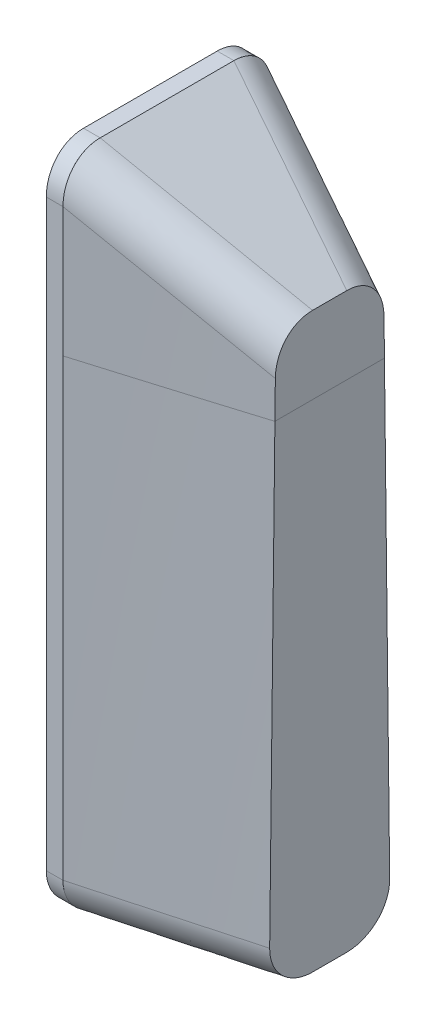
SolidWorks part; units mm, degrees
ref_plane "Alzado" through (0, 0, 0) normal (0, 0, 1) x (1, 0, 0)
ref_plane "Planta" through (0, 0, 0) normal (0, 1, 0) x (1, 0, 0)
ref_plane "Vista lateral" through (0, 0, 0) normal (1, 0, 0) x (0, 0, -1)
sketch "Croquis1" plane through (0, 0, 0) normal (0, 0, 1) x (1, 0, 0)
  line L0 (0, 0) -> (0, 160) construction
  line L1 (0, 160) -> (39.07, 137.672) construction
  line L2 (39.07, 137.672) -> (39.07, 0) construction
  line L3 (39.07, 0) -> (0, 0) construction
  dimension "D1" = 160
  dimension "D2" = 45
sketch "Croquis5" plane through (0, 0, 0) normal (0, 1, 0) x (1, 0, 0)
  line L0 (0, 0) -> (0, -25)
  line L1 (0, 0) -> (0, 25)
  line L2 (0, 25) -> (39.07, 14.5312)
  line L3 (39.07, 14.5312) -> (39.07, -14.5312)
  line L4 (39.07, -14.5312) -> (0, -25)
  dimension "D1" = 25
  dimension "D2" = 25
  dimension "D3" = 75
  dimension "D4" = 75
ref_plane "Plano2" through (68.9267, 120.6093, 0) normal (-0.4962, -0.8682, 0) x (0.8682, -0.4962, 0)
sketch "Croquis6" plane through (68.9267, 120.6093, 0) normal (-0.4962, -0.8682, 0) x (0.8682, -0.4962, 0)
  line L0 (-79.3884, 0) -> (-79.3884, 25)
  line L1 (-79.3884, 0) -> (-79.3884, -25)
  line L2 (-79.3884, 25) -> (-34.3884, 12.9423)
  line L3 (-34.3884, 12.9423) -> (-34.3884, -12.9423)
  line L4 (-34.3884, -12.9423) -> (-79.3884, -25)
  dimension "D1" = 25
  dimension "D2" = 25
  dimension "D3" = 75
  dimension "D4" = 75
loft "Recubrir1" add profiles "Croquis6", "Croquis5"
fillet "Redondeo1" radius 10 4 edges
sketch "Croquis7" plane through (0, 0, 0) normal (-1, 0, 0) x (0, 0, 1)
  line L6 (-25, 150.155) -> (-25, 10)
  line L7 (-14.6406, 0) -> (0, 0)
  line L8 (0, 0) -> (14.6406, 0)
  line L9 (25, 10) -> (25, 150.155)
  line L10 (16.0609, 160) -> (0, 160)
  line L11 (0, 160) -> (-16.0609, 160)
  line L12 (-25, 150.155) -> (-25, 10)
  line L13 (-14.6406, 0) -> (0, 0)
  line L14 (0, 0) -> (14.6406, 0)
  line L15 (25, 10) -> (25, 150.155)
  line L16 (16.0609, 160) -> (0, 160)
  line L17 (0, 160) -> (-16.0609, 160)
  spline S4 degree 3 poles (3880.9468, 860.7883) (494.7457, 218.8856) (-37.0995, 66.7661) (-24.7266, 7.6937) (-24.6419, 7.3721) (-24.4383, 6.7347) (-24.3193, 6.4195) (-23.9194, 5.5042) (-23.5939, 4.9266) (-23.0183, 4.1087) (-22.8106, 3.8429) (-22.3736, 3.3377) (-22.1439, 3.0974) (-21.4222, 2.4125) (-20.8967, 2.0026) (-19.7635, 1.2837) (-19.171, 0.984) (-18.2453, 0.6194) (-17.9305, 0.5122) (-17.2884, 0.3268) (-16.9607, 0.2487) (61.4859, -14.5892) (247.7847, 844.2737) (709.8719, 3930.3389) knots -11.189745 -11.189745 -11.189745 -11.189745 0.125 0.125 0.1875 0.1875 0.25 0.25 0.375 0.375 0.4375 0.4375 0.5 0.5 0.625 0.625 0.75 0.75 0.8125 0.8125 0.875 0.875 15.752784 15.752784 15.752784 15.752784 only from (-25, 10) to (-14.6406, 0)
  spline S5 degree 3 poles (-841.808, 3904.3773) (-209.1046, 555.1016) (-47.2488, -11.8517) (16.9511, 0.2466) (17.2742, 0.3232) (17.9152, 0.5072) (18.2346, 0.6155) (19.1676, 0.982) (19.7588, 1.2817) (20.5998, 1.8138) (20.8724, 2.005) (21.4017, 2.4163) (21.6566, 2.6353) (22.3809, 3.3217) (22.815, 3.8219) (23.3912, 4.6375) (23.5716, 4.922) (23.9009, 5.5051) (24.0496, 5.8028) (24.4486, 6.7141) (24.6525, 7.3456) (24.8605, 8.3304) (24.9128, 8.6628) (31.784, 74.3842) (-627.4827, 204.2432) (-3929.9593, 589.933) knots -12.133603 -12.133603 -12.133603 -12.133603 0.125 0.125 0.1875 0.1875 0.25 0.25 0.375 0.375 0.4375 0.4375 0.5 0.5 0.625 0.625 0.6875 0.6875 0.75 0.75 0.875 0.875 0.9375 0.9375 13.208978 13.208978 13.208978 13.208978 only from (14.6406, 0) to (25, 10)
  spline S6 degree 3 poles (3997.6896, 493.317) (-1133.0662, -227.6732) (39.7426, 56.8965) (24.763, 152.6108) (24.6194, 153.2112) (24.2217, 154.3946) (23.9737, 154.9591) (23.3765, 156.0301) (23.0274, 156.537) (22.2138, 157.4853) (21.7633, 157.9096) (21.028, 158.4658) (20.7726, 158.6381) (20.2405, 158.9556) (19.9619, 159.1015) (19.1127, 159.4874) (18.526, 159.6789) (17.6165, 159.8717) (17.307, 159.9202) (-55.8992, 167.4687) (-189.2733, -720.9033) (66.3339, 4152.8308) knots -19.421337 -19.421337 -19.421337 -19.421337 0.125 0.125 0.25 0.25 0.375 0.375 0.5 0.5 0.625 0.625 0.6875 0.6875 0.75 0.75 0.875 0.875 0.9375 0.9375 15.600185 15.600185 15.600185 15.600185 only from (25, 150.155) to (16.0609, 160)
  spline S7 degree 3 poles (-347.7414, 4128.1446) (499.0069, -1686.1904) (85.5813, 181.517) (-18.2038, 159.7479) (-18.5028, 159.6684) (-19.0953, 159.4755) (-19.3858, 159.3628) (-20.2292, 158.981) (-20.7588, 158.6674) (-21.5037, 158.1069) (-21.7431, 157.9052) (-22.194, 157.4817) (-22.4071, 157.2589) (-22.8096, 156.7919) (-22.9989, 156.5477) (-23.354, 156.0382) (-23.5197, 155.7727) (-23.9728, 154.9619) (-24.2205, 154.3969) (-24.5172, 153.5159) (-24.6038, 153.2155) (-24.7501, 152.6125) (-24.8102, 152.3092) (-38.2134, 66.7523) (906.2321, -148.3983) (-4005.453, 430.6693) knots -21.315227 -21.315227 -21.315227 -21.315227 0.125 0.125 0.1875 0.1875 0.25 0.25 0.375 0.375 0.4375 0.4375 0.5 0.5 0.5625 0.5625 0.625 0.625 0.75 0.75 0.8125 0.8125 0.875 0.875 18.347767 18.347767 18.347767 18.347767 only from (-16.0609, 160) to (-25, 150.155)
  spline S8 degree 3 poles (-25, 10) (-25, 9.3277) (-24.9305, 8.6672) (-24.7266, 7.6937) (-24.6419, 7.3721) (-24.4383, 6.7347) (-24.3193, 6.4195) (-23.9194, 5.5042) (-23.5939, 4.9266) (-23.0183, 4.1087) (-22.8106, 3.8429) (-22.3736, 3.3377) (-22.1439, 3.0974) (-21.4222, 2.4125) (-20.8967, 2.0026) (-19.7635, 1.2837) (-19.171, 0.984) (-18.2453, 0.6194) (-17.9305, 0.5122) (-17.2884, 0.3268) (-16.9607, 0.2487) (-15.9762, 0.0625) (-15.3123, 0) (-14.6406, 0) knots 0 0 0 0 0.125 0.125 0.1875 0.1875 0.25 0.25 0.375 0.375 0.4375 0.4375 0.5 0.5 0.625 0.625 0.75 0.75 0.8125 0.8125 0.875 0.875 1 1 1 1
  spline S9 degree 3 poles (14.6406, 0) (15.3127, 0) (15.9742, 0.0625) (16.9511, 0.2466) (17.2742, 0.3232) (17.9152, 0.5072) (18.2346, 0.6155) (19.1676, 0.982) (19.7588, 1.2817) (20.5998, 1.8138) (20.8724, 2.005) (21.4017, 2.4163) (21.6566, 2.6353) (22.3809, 3.3217) (22.815, 3.8219) (23.3912, 4.6375) (23.5716, 4.922) (23.9009, 5.5051) (24.0496, 5.8028) (24.4486, 6.7141) (24.6525, 7.3456) (24.8605, 8.3304) (24.9128, 8.6628) (24.9825, 9.3289) (25, 9.6636) (25, 10) knots 0 0 0 0 0.125 0.125 0.1875 0.1875 0.25 0.25 0.375 0.375 0.4375 0.4375 0.5 0.5 0.625 0.625 0.6875 0.6875 0.75 0.75 0.875 0.875 0.9375 0.9375 1 1 1 1
  spline S10 degree 3 poles (25, 150.155) (25, 150.7784) (24.9534, 151.3943) (24.763, 152.6108) (24.6194, 153.2112) (24.2217, 154.3946) (23.9737, 154.9591) (23.3765, 156.0301) (23.0274, 156.537) (22.2138, 157.4853) (21.7633, 157.9096) (21.028, 158.4658) (20.7726, 158.6381) (20.2405, 158.9556) (19.9619, 159.1015) (19.1127, 159.4874) (18.526, 159.6789) (17.6165, 159.8717) (17.307, 159.9202) (16.6856, 159.9842) (16.3738, 160) (16.0609, 160) knots 0 0 0 0 0.125 0.125 0.25 0.25 0.375 0.375 0.5 0.5 0.625 0.625 0.6875 0.6875 0.75 0.75 0.875 0.875 0.9375 0.9375 1 1 1 1
  spline S11 degree 3 poles (-16.0609, 160) (-16.685, 160) (-17.2988, 159.9377) (-18.2038, 159.7479) (-18.5028, 159.6684) (-19.0953, 159.4755) (-19.3858, 159.3628) (-20.2292, 158.981) (-20.7588, 158.6674) (-21.5037, 158.1069) (-21.7431, 157.9052) (-22.194, 157.4817) (-22.4071, 157.2589) (-22.8096, 156.7919) (-22.9989, 156.5477) (-23.354, 156.0382) (-23.5197, 155.7727) (-23.9728, 154.9619) (-24.2205, 154.3969) (-24.5172, 153.5159) (-24.6038, 153.2155) (-24.7501, 152.6125) (-24.8102, 152.3092) (-24.9535, 151.3944) (-25, 150.7778) (-25, 150.155) knots 0 0 0 0 0.125 0.125 0.1875 0.1875 0.25 0.25 0.375 0.375 0.4375 0.4375 0.5 0.5 0.5625 0.5625 0.625 0.625 0.75 0.75 0.8125 0.8125 0.875 0.875 1 1 1 1
  dimension "D1" = 0
extrude "Saliente-Extruir1" add sketch "Croquis7" along normal blind 4 separate body
sketch "Croquis8" plane through (-4, 0, 0) normal (-1, 0, 0) x (0, 0, 1)
  line L1 (0.4368, 130.8347) -> (-0.4368, 130.8347)
  line L2 (2.4368, 132.8347) -> (2.4368, 141.1512)
  line L3 (0.4368, 143.1512) -> (-0.4368, 143.1512)
  line L4 (-2.4368, 132.8347) -> (-2.4368, 141.1512)
  line L5 (2.4368, 130.8347) -> (-2.4368, 143.1512) construction
  line L6 (2.4368, 143.1512) -> (-2.4368, 130.8347) construction
  arc A0 (-0.4368, 130.8347) -> (-2.4368, 132.8347) centre (-0.4368, 132.8347) cw
  arc A1 (0.4368, 130.8347) -> (2.4368, 132.8347) centre (0.4368, 132.8347) ccw
  arc A2 (2.4368, 141.1512) -> (0.4368, 143.1512) centre (0.4368, 141.1512) ccw
  arc A3 (-0.4368, 143.1512) -> (-2.4368, 141.1512) centre (-0.4368, 141.1512) ccw
  point P0 (0, 136.993)
  dimension "D1" = 2
extrude "Cortar-Extruir1" cut sketch "Croquis8" against normal blind 4
sketch "Croquis9" plane through (0, 0, 0) normal (0, 0, 1) x (1, 0, 0)
  line L0 (0, 119.104) -> (39.9446, 119.104)
split "Partir1" trim tools "Croquis9" bodies to split 103 101 resulting bodies 104 105 106
